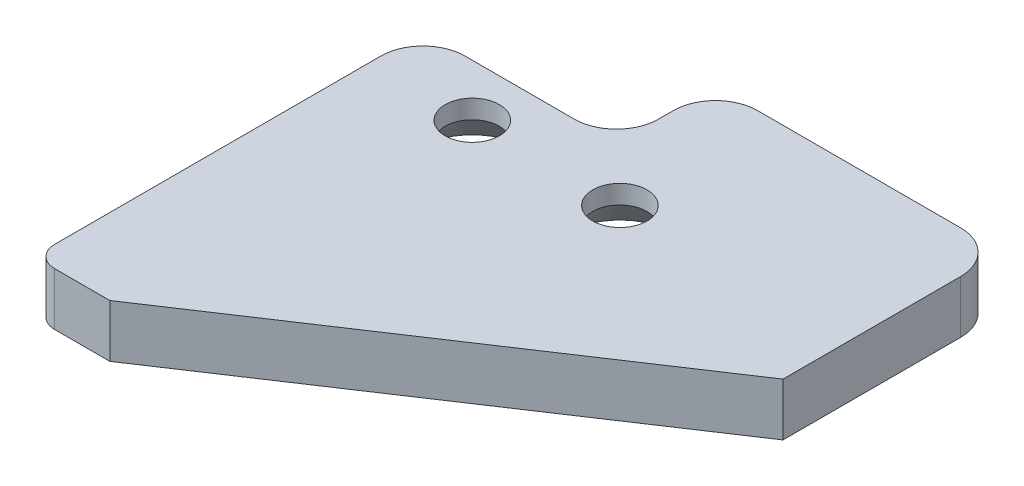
SolidWorks part; units mm, degrees
ref_plane "Front Plane" through (0, 0, 0) normal (0, 0, 1) x (1, 0, 0)
ref_plane "Top Plane" through (0, 0, 0) normal (0, 1, 0) x (1, 0, 0)
ref_plane "Right Plane" through (0, 0, 0) normal (1, 0, 0) x (0, 0, -1)
sketch "Sketch1" plane through (0, 0, 0) normal (0, 1, 0) x (1, 0, 0)
  line L0 (15.5503, 12.5405) -> (15.5503, -0.6995)
  line L1 (-8.8238, -16.8737) -> (-13.4141, -16.8737)
  line L2 (-13.4141, -16.8737) -> (-13.4141, 6.5765)
  line L3 (-13.4141, 6.5765) -> (-1.7599, 6.5765)
  line L4 (-1.7599, 6.5765) -> (-1.7599, 12.5405)
  line L5 (-1.7599, 12.5405) -> (15.5503, 12.5405)
  line L6 (-8.8238, -16.8737) -> (15.5503, -0.6995)
extrude "Boss-Extrude1" add sketch "Sketch1" along normal blind 3.175
hole_wizard "CSK for #4 Flat Head Machine Screw1" positions "Sketch2" profile "Sketch3" countersink size "#4" standard "ANSI Inch"
sketch "Sketch2" plane through (0, 0, 0) normal (0, 1, 0) x (1, 0, 0)
  line L0 (-7.3097, 3.4463) -> (1.5803, 3.4463) construction
  line L4 (-13.4141, -16.8737) -> (-8.8238, -16.8737) construction
  line L5 (15.5503, -0.6995) -> (15.5503, 12.5405) construction
  point P0 (-7.3097, 3.4463)
  point P5 (1.5803, 3.4463)
  dimension "D1" = 8.89
  dimension "D2" = 20.32
  dimension "D3" = 13.97
sketch "Sketch3" plane through (-7.3097, 0, -3.4463) normal (1, 0, 0) x (0, 0, -1)
  line L0 (0, 0) -> (0, 3.175)
  line L1 (0, 3.175) -> (1.6319, 3.175)
  line L2 (1.6319, 3.175) -> (1.6319, 2.0448)
  line L3 (1.6319, 2.0448) -> (3.4095, 0)
  line L5 (3.4095, 0) -> (0, 0)
  line L6 (-1.632, 2.0448) -> (-3.4095, 0) construction
  line L11 (0, -6.35) -> (0, 107.95) construction
  dimension "Thru Hole Dia." = 3.2639
  dimension "Thru Hole Depth" = 3.175
  dimension "Near C'Sink Dia." = 6.819
  dimension "Near C'Sink Angle" = 82
fillet "Fillet1" radius 2.54 1 edges at (-1.7599, 1.5875, -12.5405)
fillet "Fillet2" radius 2.54 1 edges at (-1.7599, 1.5875, -6.5765)
fillet "Fillet3" radius 2.54 1 edges at (15.5503, 1.5875, -12.5405)
fillet "Fillet4" radius 2.54 1 edges at (-13.4141, 1.5875, -6.5765)
fillet "Fillet5" radius 1.27 1 edges at (-13.4141, 1.5875, 16.8737)
